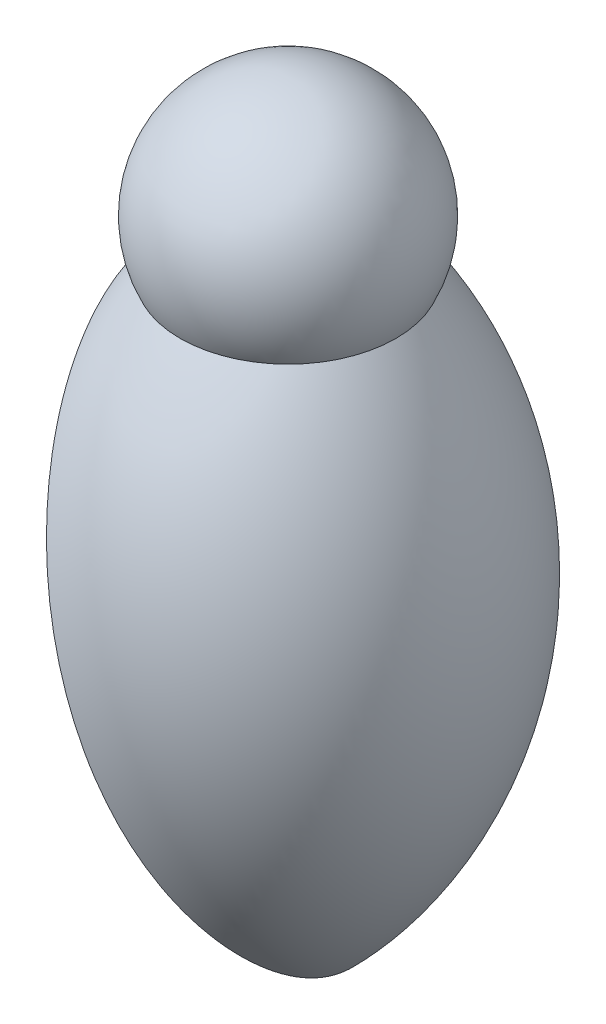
SolidWorks part; units mm, degrees
ref_plane "Přední" through (0, 0, 0) normal (0, 0, 1) x (1, 0, 0)
ref_plane "Horní" through (0, 0, 0) normal (0, 1, 0) x (1, 0, 0)
ref_plane "Pravá" through (0, 0, 0) normal (1, 0, 0) x (0, 0, -1)
sketch "Skica1" plane through (0, 0, 0) normal (0, 0, 1) x (1, 0, 0)
  line L0 (0, 0) -> (0, 189.75)
  line L1 (0, 0) -> (0, -27.2159) construction
  line L2 (0, 161) -> (28.75, 161) construction
  line L3 (46, 86.7298) -> (0, 86.7298) construction
  arc A0 (0, 189.75) -> (25.875, 148.4682) centre (0, 161) cw
  arc A1 (25.875, 148.4682) -> (0, 0) centre (-58.7614, 86.7298) cw
  dimension "D1" = 57.5
  dimension "D2" = 161
  dimension "D3" = 92
  dimension "D4" = 51.75
revolve "Otočit kolem osy1" add sketch "Skica1" angle 360 about L0
sketch "Skica2" plane through (0, 0, 0) normal (0, 0, 1) x (1, 0, 0)
  line L0 (-32, 148.4682) -> (20, 0)
  line L1 (25.875, 148.4682) -> (-25.875, 148.4682) construction
  point P4 (0, 148.4682)
  dimension "D1" = 32
  dimension "D2" = 20
sketch "Skica3" plane through (0, 0, 0) normal (0, 1, 0) x (1, 0, 0)
  line L0 (20, 0) -> (20, -41.3394)
ref_plane "Rovina1" through (17.8147, 6.2395, 0) normal (-0.9438, -0.3306, 0) x (0, 0, 1)
other "Odebrat povrchem1"
